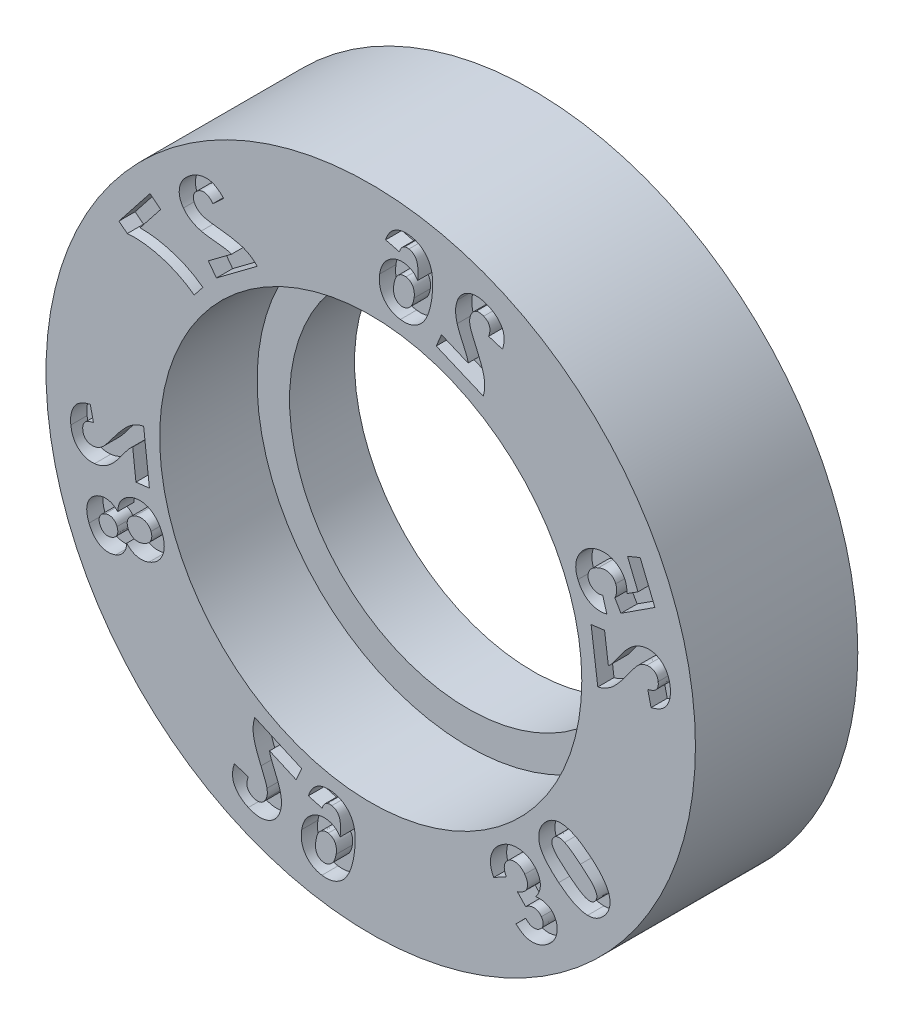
SolidWorks part; units mm, degrees
ref_plane "Front Plane" through (0, 0, 0) normal (0, 0, 1) x (1, 0, 0)
ref_plane "Top Plane" through (0, 0, 0) normal (0, 1, 0) x (1, 0, 0)
ref_plane "Right Plane" through (0, 0, 0) normal (1, 0, 0) x (0, 0, -1)
imported_body "Imported1"
other "DeleteFace1"
sketch "Sketch1" plane through (0, 0, 0) normal (0, 0, 1) x (1, 0, 0)
  line L0 (0, 0) -> (0, 11.8635) construction
  line L1 (0, 0) -> (10.2741, 5.9318) construction
  line L2 (0, 0) -> (10.2741, -5.9318) construction
  line L3 (0, 0) -> (0, -11.8635) construction
  line L4 (0, 0) -> (-10.2741, -5.9318) construction
  line L5 (0, 0) -> (-10.2741, 5.9318) construction
  circle A0 centre (0, 0) radius 7.0035 construction
  text T0 "25    26    27    28    29    30" font "Arial" height 2.37
  point P12 (0, 0)
  dimension "D1" = 6
extrude "Cut-Extrude1" cut sketch "Sketch1" against normal blind 0.5
